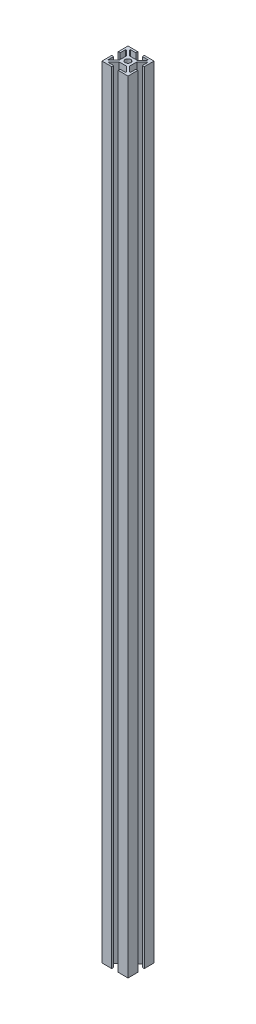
SolidWorks part; units mm, degrees
ref_plane "Front Plane" through (0, 0, 0) normal (0, 0, 1) x (1, 0, 0)
ref_plane "Top Plane" through (0, 0, 0) normal (0, 1, 0) x (1, 0, 0)
ref_plane "Right Plane" through (0, 0, 0) normal (1, 0, 0) x (0, 0, -1)
sketch "Sketch1" plane through (0, 0, 0) normal (0, 1, 0) x (1, 0, 0)
  line L0 (-2.5, -993.4222) -> (-2.5, 49006.5778) construction
  line L1 (-10, 10) -> (-2.5, 10)
  line L2 (-10, 10) -> (-10, 2.5)
  line L3 (-10, -10) -> (-2.5, -10)
  line L4 (10, 10) -> (10, 2.5)
  line L5 (2.5, -994.5334) -> (2.5, 49005.4666) construction
  line L6 (-997.8427, 8.5) -> (49002.1573, 8.5) construction
  line L7 (-999.56, -8.5) -> (49000.44, -8.5) construction
  line L8 (8.5, -999.3828) -> (8.5, 49000.6172) construction
  line L9 (-2.9748, 4) -> (2.9748, 4)
  line L10 (-4, 2.9038) -> (-4, -2.9038)
  line L11 (-2.9748, -4) -> (2.9748, -4)
  line L12 (4, 2.9038) -> (4, -2.9038)
  line L13 (-8.5, -996.7327) -> (-8.5, 49003.2673) construction
  line L14 (2.5, 10) -> (2.5, 8.5)
  line L15 (2.5, 8.5) -> (6.75, 8.5)
  line L16 (8.5, 6.75) -> (8.5, 2.5)
  line L17 (8.5, 2.5) -> (10, 2.5)
  line L18 (-2.5, 10) -> (-2.5, 8.5)
  line L19 (-2.5, 8.5) -> (-6.75, 8.5)
  line L20 (-8.5, 6.75) -> (-8.5, 2.5)
  line L21 (-8.5, 2.5) -> (-10, 2.5)
  line L22 (-2.5, -10) -> (-2.5, -8.5)
  line L23 (-2.5, -8.5) -> (-6.75, -8.5)
  line L24 (-8.5, -6.75) -> (-8.5, -2.5)
  line L25 (-8.5, -2.5) -> (-10, -2.5)
  line L26 (2.5, -10) -> (2.5, -8.5)
  line L27 (2.5, -8.5) -> (6.75, -8.5)
  line L28 (8.5, -6.75) -> (8.5, -2.5)
  line L29 (8.5, -2.5) -> (10, -2.5)
  line L30 (2.5, 10) -> (10, 10)
  line L31 (-10, -2.5) -> (-10, -10)
  line L32 (10, -2.5) -> (10, -10)
  line L33 (0, 0) -> (35355.3391, 35355.3391) construction
  line L34 (2.9748, 4) -> (6.75, 7.7752)
  line L35 (4, 2.9038) -> (7.8462, 6.75)
  line L36 (-1012.3135, 6.75) -> (48987.6865, 6.75) construction
  line L37 (7.8462, 6.75) -> (8.5, 6.75)
  line L38 (6.75, -989.0284) -> (6.75, 49010.9716) construction
  line L39 (6.75, 7.7752) -> (6.75, 8.5)
  line L40 (0, -1000) -> (0, 49000) construction
  line L41 (-1000, 0) -> (49000, 0) construction
  line L42 (-6.75, 7.7752) -> (-6.75, 8.5)
  line L43 (-7.8462, 6.75) -> (-8.5, 6.75)
  line L44 (-2.9748, 4) -> (-6.75, 7.7752)
  line L45 (-4, 2.9038) -> (-7.8462, 6.75)
  line L46 (6.75, -7.7752) -> (6.75, -8.5)
  line L47 (7.8462, -6.75) -> (8.5, -6.75)
  line L48 (4, -2.9038) -> (7.8462, -6.75)
  line L49 (2.9748, -4) -> (6.75, -7.7752)
  line L50 (-2.9748, -4) -> (-6.75, -7.7752)
  line L51 (-6.75, -7.7752) -> (-6.75, -8.5)
  line L52 (-7.8462, -6.75) -> (-8.5, -6.75)
  line L53 (-4, -2.9038) -> (-7.8462, -6.75)
  line L54 (2.5, -10) -> (10, -10)
  circle A0 centre (0, 0) radius 2.15
  dimension "D7" = 4.3
  dimension "D1" = 20
  dimension "D2" = 20
  dimension "D3" = 10
  dimension "D4" = 10
  dimension "D5" = 7.5
  dimension "D6" = 7.5
  dimension "D9" = 4
  dimension "D10" = 4
  dimension "D11" = 1.5
  dimension "D13" = 7.5
  dimension "D15" = 7.5
  dimension "D16" = 1.5
  dimension "D17" = 7.5
  dimension "D18" = 7.5
  dimension "D19" = 1.5
  dimension "D20" = 3.25
  dimension "D21" = 3.25
extrude "Boss-Extrude1" add sketch "Sketch1" along normal blind 600
